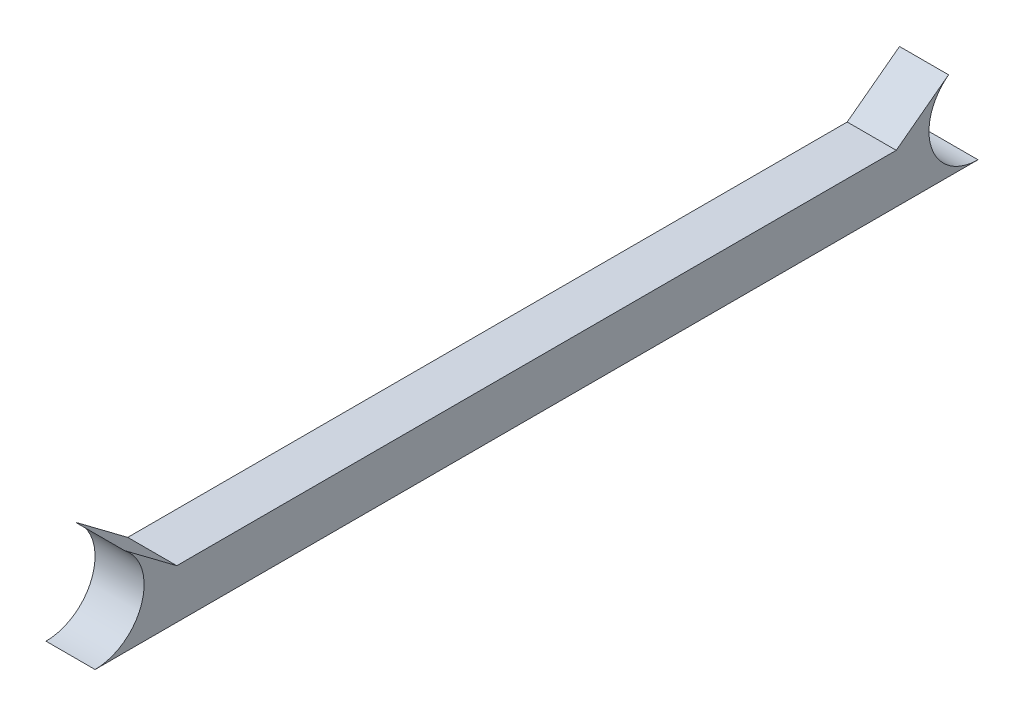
SolidWorks part; units mm, degrees
ref_plane "Piano frontale" through (0, 0, 0) normal (0, 0, 1) x (1, 0, 0)
ref_plane "Piano superiore" through (0, 0, 0) normal (0, 1, 0) x (1, 0, 0)
ref_plane "Piano destro" through (0, 0, 0) normal (1, 0, 0) x (0, 0, -1)
sketch "Sketch1" plane through (0, 0, 0) normal (1, 0, 0) x (0, 0, -1)
  line L0 (0, 0) -> (405, 0) construction
  line L1 (405, 0) -> (405, 180) construction
  line L2 (0, 0) -> (0, 36) construction
  line L3 (0, 36) -> (405, 36) construction
  line L4 (0, -45) -> (810, -45)
  line L5 (27, 36) -> (75, 0)
  line L6 (75, 0) -> (735, 0)
  line L7 (783, 36) -> (735, 0)
  arc A0 (0, -45) -> (27, 36) centre (0, 0) ccw
  arc A1 (810, -45) -> (783, 36) centre (810, 0) cw
  point P11 (405, -45)
extrude "Boss-Extrude1" add sketch "Sketch1" along normal mid plane 45
